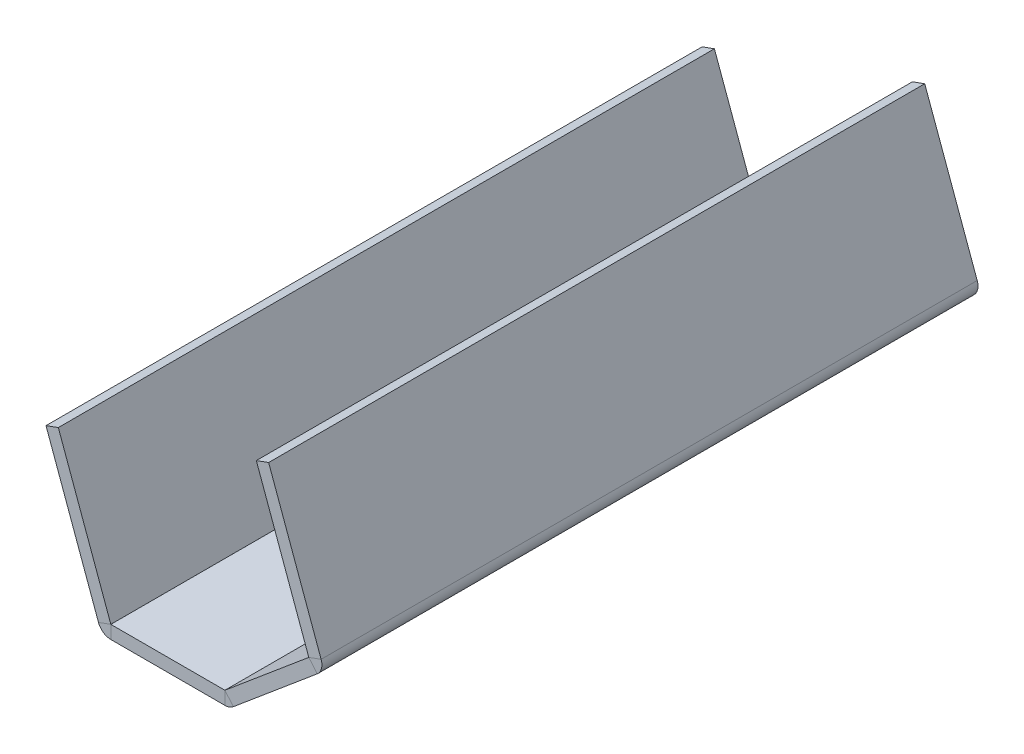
SolidWorks part; units mm, degrees
ref_plane "Front Plane" through (0, 0, 0) normal (0, 0, 1) x (1, 0, 0)
ref_plane "Top Plane" through (0, 0, 0) normal (0, 1, 0) x (1, 0, 0)
ref_plane "Right Plane" through (0, 0, 0) normal (1, 0, 0) x (0, 0, -1)
sketch "Sketch1" plane through (0, 0, 0) normal (0, 1, 0) x (1, 0, 0)
  line L0 (21, 0) -> (21, 50) construction
  line L1 (0, 0) -> (42, 0)
  line L2 (0, 0) -> (0, 50)
  line L3 (0, 50) -> (42, 50)
  line L4 (42, 0) -> (42, 50)
  circle A0 centre (21, 40) radius 1.75
  circle A1 centre (21, 10) radius 1.75
  dimension "D3" = 10
  dimension "D4" = 10
  dimension "D5" = 3.5
  dimension "D1" = 50
  dimension "D2" = 42
sheet metal parameters "Sheet-Metal1" thickness 1 parameters "D1"=0.7366
base flange "Base-Flange1" sketch "Sketch1" thickness 1 reverse thickness direction yes parameters "D1"=0.7366
sketch "Sketch3" plane through (0, 1, 0) normal (0, 1, 0) x (1, 0, 0)
  line L0 (12, 50) -> (12, 0)
  line L1 (42, 50) -> (0, 50) construction
  line L2 (0, 0) -> (42, 0) construction
  line L3 (30, 50) -> (30, 0)
  line L4 (0, 50) -> (0, 0) construction
  line L5 (42, 0) -> (42, 50) construction
  dimension "D1" = 12
  dimension "D2" = 12
sketched bend "Sketched Bend1" parameters "D1"=0.001
bend "SketchBend1" bend radius 0.001 bend angle 70 parameters "D5"=1
bend "SketchBend2" bend radius 0 bend angle 70 parameters "D5"=2
sketch "Sketch4" plane through (0, 1, 0) normal (0, 1, 0) x (1, 0, 0)
  line L0 (21, 50) -> (21, 0)
  line L1 (29.694, 50) -> (12.306, 50) construction
  line L2 (12.306, 0) -> (29.694, 0) construction
sketched bend "Sketched Bend4" parameters "D1"=0.001
bend "SketchBend5" bend radius 0.001 bend angle 40 parameters "D5"=3
ref_plane "Plane1" through (2.1351, -5.8661, 0) normal (-0.342, 0.9397, 0) x (0, 0, 1)
sketch "Sketch5" plane through (2.1351, -5.8661, 0) normal (-0.342, 0.9397, 0) x (0, 0, 1)
  line L0 (0, 20.0756) -> (-50, 20.0756) construction
  line L1 (0, 20.0752) -> (0, 20.0759) construction
  line L2 (-50, 20.0759) -> (-50, 20.0752) construction
  line L3 (-50, 27.9172) -> (-50, 20.0759) construction
  line L4 (0, 20.0759) -> (0, 27.9172) construction
  circle A0 centre (-10, 20.0756) radius 0.005
  circle A1 centre (-40, 20.0756) radius 0.005
  dimension "D1" = 10
  dimension "D2" = 10
  dimension "D3" = 0.01
extrude "Boss-Extrude1" add sketch "Sketch5" along normal blind 1 separate body
flat pattern "Flat-Pattern1"
sketch "Bend-Lines1" plane through (0, 0, 0) normal (0, 1, 0) x (-1, 0, 0)
bend of the flat pattern "Flatten-<SketchBend1>1"
bend of the flat pattern "Flatten-<SketchBend2>1"
bend of the flat pattern "Flatten-<SketchBend5>1"
